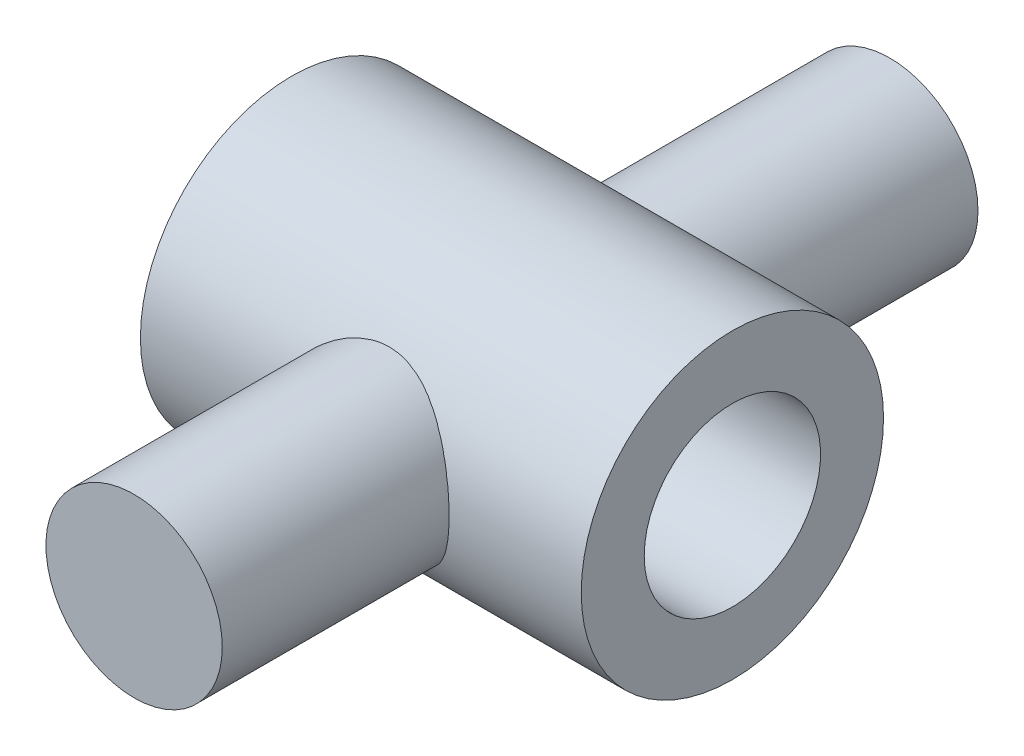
SolidWorks part; units mm, degrees
ref_plane "Front Plane" through (0, 0, 0) normal (0, 0, 1) x (1, 0, 0)
ref_plane "Top Plane" through (0, 0, 0) normal (0, 1, 0) x (1, 0, 0)
ref_plane "Right Plane" through (0, 0, 0) normal (1, 0, 0) x (0, 0, -1)
sketch "Sketch1" plane through (0, 0, 0) normal (0, 0, 1) x (1, 0, 0)
  line L0 (0, 0) -> (0, 7) construction
  line L1 (-17.5, 12) -> (17.5, 12)
  line L2 (0, 0) -> (17.5, 0) construction
  line L3 (-17.5, 12) -> (-17.5, 7)
  line L4 (-17.5, 7) -> (17.5, 7)
  line L5 (17.5, 7) -> (17.5, 12)
  dimension "D1" = 24
  dimension "D2" = 35
  dimension "D3" = 14
revolve "Revolve1" add sketch "Sketch1" angle 360 about L2
sketch "Sketch2" plane through (0, 0, 0) normal (0, 0, 1) x (1, 0, 0)
  circle A0 centre (0, 0) radius 7
  dimension "D1" = 14
extrude "Extrude2" add sketch "Sketch2" along normal mid plane 60 separate body
sketch "Sketch3" plane through (17.5, 0, 0) normal (1, 0, 0) x (0, 0, -1)
  circle A0 centre (0, 0) radius 7 construction
  circle A1 centre (0, 0) radius 7
extrude "Cut-Extrude1" cut sketch "Sketch3" against normal through all
